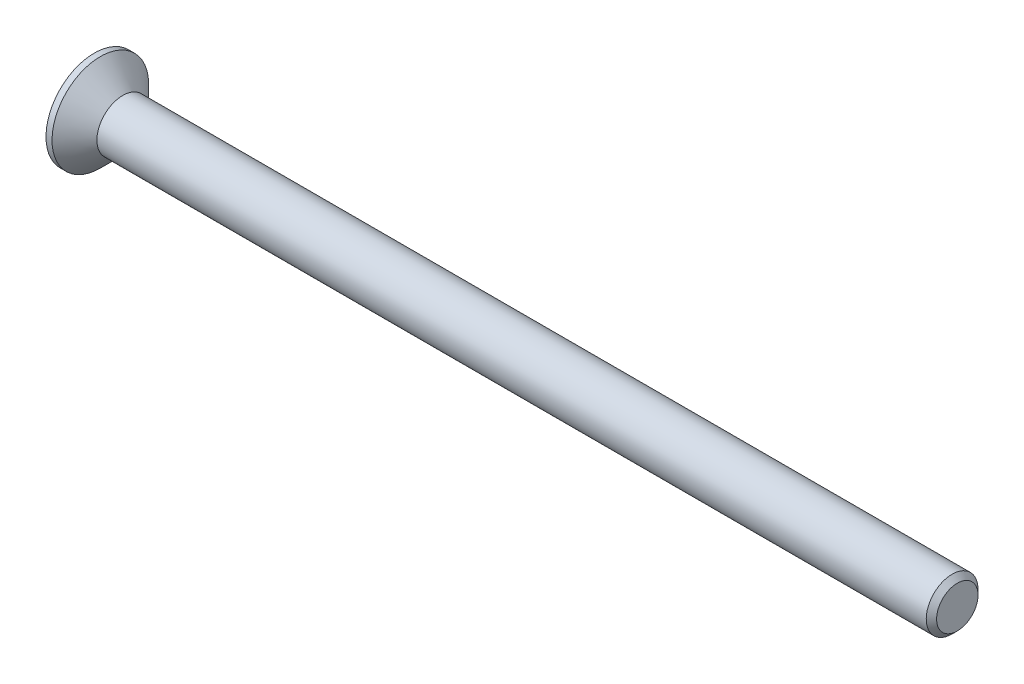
SolidWorks part; units mm, degrees
ref_plane "Front Plane" through (0, 0, 0) normal (0, 0, 1) x (1, 0, 0)
ref_plane "Top Plane" through (0, 0, 0) normal (0, 1, 0) x (1, 0, 0)
ref_plane "Right Plane" through (0, 0, 0) normal (1, 0, 0) x (0, 0, -1)
sketch "Sketch1" plane through (0, 0, 0) normal (0, 0, 1) x (1, 0, 0)
  line L1 (-1.65, 2.8) -> (-1.65, 0)
  line L2 (-1.65, 0) -> (48.35, 0)
  line L3 (48.35, 0) -> (48.35, 1.5)
  line L4 (48.35, 1.5) -> (0, 1.5)
  line L5 (-1.65, 2.8) -> (-1.3, 2.8)
  line L6 (-1.3, 2.8) -> (0, 1.5)
  dimension "D1" = 1.5
  dimension "D2" = 45
  dimension "D3" = 1.65
  dimension "D4" = 50
  dimension "D5" = 2.8
revolve "Revolve1" add sketch "Sketch1" angle 360 about L2
chamfer "Chamfer1" distance 0.3 angle 45 1 edges at (48.35, -1.5, 0)
sketch "Sketch2" plane through (-1.65, 0, 0) normal (-1, 0, 0) x (0, 0, 1)
  line L0 (-0.365, 1.45) -> (0.365, 1.45)
  line L1 (0.365, 1.45) -> (0.365, 0.365)
  line L2 (0.365, 0.365) -> (1.45, 0.365)
  line L3 (1.45, 0.365) -> (1.45, -0.365)
  line L4 (1.45, -0.365) -> (0.365, -0.365)
  line L5 (0.365, -0.365) -> (0.365, -1.45)
  line L6 (0.365, -1.45) -> (-0.365, -1.45)
  line L7 (-0.365, -1.45) -> (-0.365, -0.365)
  line L8 (-0.365, -0.365) -> (-1.45, -0.365)
  line L9 (-1.45, -0.365) -> (-1.45, 0.365)
  line L10 (-1.45, 0.365) -> (-0.365, 0.365)
  line L11 (-0.365, 0.365) -> (-0.365, 1.45)
  point P2 (0, 1.45)
  point P14 (0, -1.45)
  point P15 (1.45, 0)
  point P16 (-1.45, 0)
  dimension "D1" = 2.9
  dimension "D2" = 0.73
extrude "Cut-Extrude1" cut sketch "Sketch2" against normal blind 1.25
